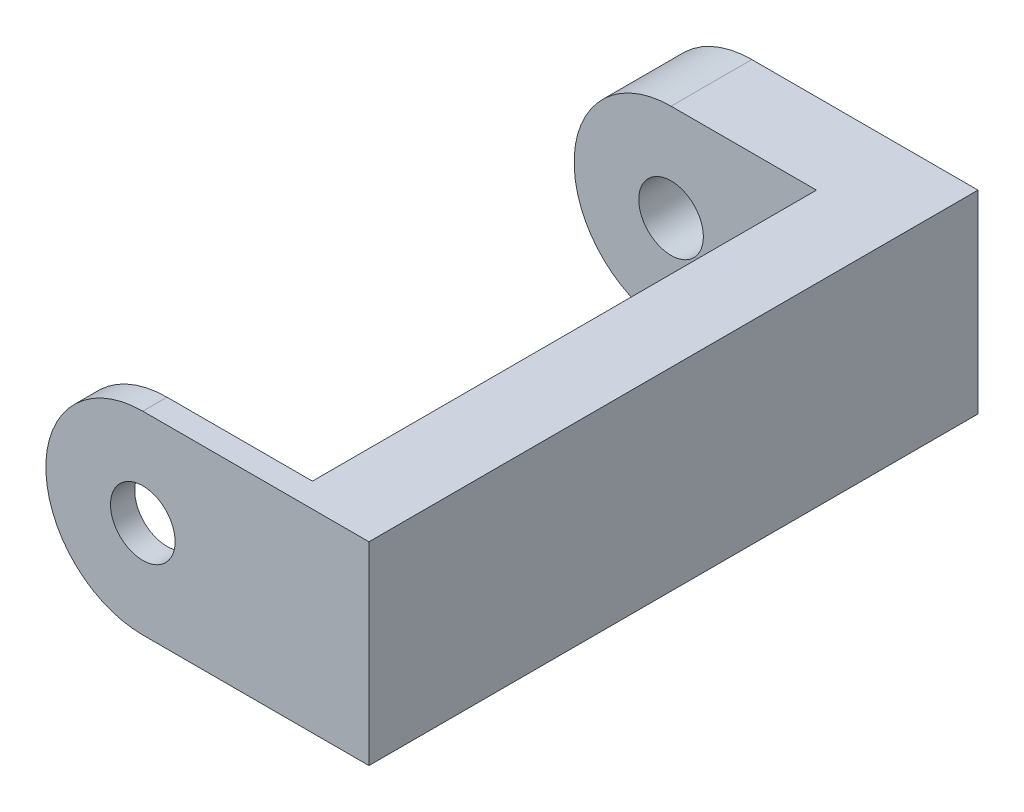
SolidWorks part; units mm, degrees
ref_plane "Front Plane" through (0, 0, 0) normal (0, 0, 1) x (1, 0, 0)
ref_plane "Top Plane" through (0, 0, 0) normal (0, 1, 0) x (1, 0, 0)
ref_plane "Right Plane" through (0, 0, 0) normal (1, 0, 0) x (0, 0, -1)
sketch "Sketch2" plane through (0, 0, 0) normal (0, 0, 1) x (1, 0, 0)
  line L2 (0, -12) -> (28, -12)
  line L4 (0, 12) -> (28, 12)
  line L5 (28, -12) -> (28, 12)
  arc A1 (0, 12) -> (0, -12) centre (0, 0) ccw
extrude "Boss-Extrude3" add sketch "Sketch2" along normal blind 75.4 contours L4 A1 L2 L5
sketch "Sketch3" plane through (0, -12, 0) normal (0, -1, 0) x (1, 0, 0)
  line L0 (28, 75.4) -> (28, 0) construction
  line L1 (18, 10) -> (-22.6636, 10)
  line L2 (18, 10) -> (18, 72.4)
  line L3 (18, 72.4) -> (-22.6636, 72.4)
  line L4 (-22.6636, 10) -> (-22.6636, 72.4)
  line L5 (0, 75.4) -> (28, 75.4) construction
  line L6 (0, 0) -> (28, 0) construction
  dimension "D1" = 10
  dimension "D2" = 3
  dimension "D3" = 10
extrude "Cut-Extrude1" cut sketch "Sketch3" against normal blind 75.4
hole_wizard "Ø8.0mm Dowel Hole2" positions "Sketch4" profile "Sketch6" hole size "Ø8.0" standard "ISO"
sketch "Sketch4" plane through (0, 0, 75.4) normal (0, 0, 1) x (1, 0, 0)
  point P0 (0, 0)
sketch "Sketch6" plane through (0, 0, 75.4) normal (1, 0, 0) x (0, -1, 0)
  line L0 (0, 0) -> (0, 5.4034)
  line L1 (0, 5.4034) -> (4, 3)
  line L2 (4, 3) -> (4, 0)
  line L5 (4, 0) -> (0, 0)
  line L10 (0, 5.4034) -> (-4, 3) construction
  line L11 (0, -6.35) -> (0, 107.95) construction
  dimension "Hole Dia." = 8
  dimension "Hole Depth" = 3
  dimension "Drill Angle" = 118
hole_wizard "Ø8.0mm Dowel Hole1" positions "Sketch7" profile "Sketch9" hole size "Ø8.0" standard "ISO"
sketch "Sketch7" plane through (0, 0, 10) normal (0, 0, 1) x (1, 0, 0)
  point P0 (0, 0)
sketch "Sketch9" plane through (0, 0, 10) normal (1, 0, 0) x (0, -1, 0)
  line L0 (0, 0) -> (0, 10)
  line L1 (0, 10) -> (4, 10)
  line L2 (4, 10) -> (4, 0)
  line L5 (4, 0) -> (0, 0)
  line L11 (0, -6.35) -> (0, 107.95) construction
  dimension "Thru Hole Dia." = 8
  dimension "Thru Hole Depth" = 10
